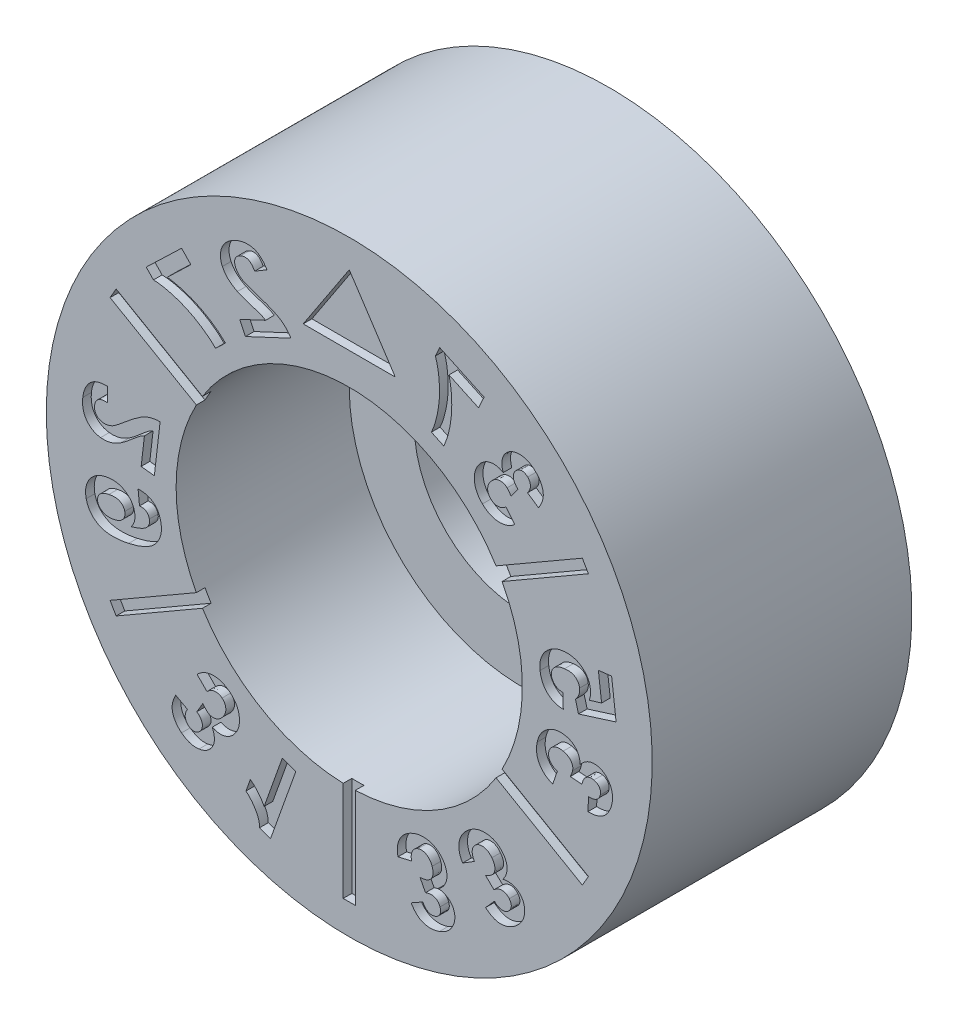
SolidWorks part; units mm, degrees
ref_plane "Front Plane" through (0, 0, 0) normal (0, 0, 1) x (1, 0, 0)
ref_plane "Top Plane" through (0, 0, 0) normal (0, 1, 0) x (1, 0, 0)
ref_plane "Right Plane" through (0, 0, 0) normal (1, 0, 0) x (0, 0, -1)
imported_body "Imported1"
other "Move Face1" parameters "D1"=0.22
other "DeleteFace2"
sketch "Sketch1" plane through (0, 0, 0) normal (0, 0, 1) x (1, 0, 0)
  line L0 (0, 0) -> (0, -3.9447) construction
  line L2 (-0.07, -1.65) -> (0.07, -1.65)
  line L3 (-0.07, -1.65) -> (-0.07, -3.15)
  line L4 (-0.07, -3.15) -> (0.07, -3.15)
  line L5 (0.07, -1.65) -> (0.07, -3.15)
  line L9 (0, 0) -> (-1.9723, -3.4162) construction
  line L10 (-1.4639, -0.7644) -> (-1.3939, -0.8856)
  line L11 (-1.3939, -0.8856) -> (-2.693, -1.6356)
  line L12 (-1.4639, -0.7644) -> (-2.763, -1.5144)
  line L13 (-2.763, -1.5144) -> (-2.693, -1.6356)
  line L14 (0, 0) -> (-3.4162, -1.9723) construction
  line L19 (0, 0) -> (-3.9447, 0) construction
  line L20 (-1.3939, 0.8856) -> (-1.4639, 0.7644)
  line L21 (-1.4639, 0.7644) -> (-2.763, 1.5144)
  line L22 (-1.3939, 0.8856) -> (-2.693, 1.6356)
  line L23 (-2.693, 1.6356) -> (-2.763, 1.5144)
  line L24 (0, 0) -> (-3.4162, 1.9723) construction
  line L29 (0, 0) -> (-1.9723, 3.4162) construction
  line L34 (0, 0) -> (0, 3.9447) construction
  line L39 (0, 0) -> (1.9723, 3.4162) construction
  line L40 (1.4639, 0.7644) -> (1.3939, 0.8856)
  line L41 (1.3939, 0.8856) -> (2.693, 1.6356)
  line L42 (1.4639, 0.7644) -> (2.763, 1.5144)
  line L43 (2.763, 1.5144) -> (2.693, 1.6356)
  line L44 (0, 0) -> (3.4162, 1.9723) construction
  line L49 (0, 0) -> (3.9447, 0) construction
  line L50 (1.3939, -0.8856) -> (1.4639, -0.7644)
  line L51 (1.4639, -0.7644) -> (2.763, -1.5144)
  line L52 (1.3939, -0.8856) -> (2.693, -1.6356)
  line L53 (2.693, -1.6356) -> (2.763, -1.5144)
  line L54 (0, 0) -> (3.4162, -1.9723) construction
  line L59 (0, 0) -> (1.9723, -3.4162) construction
  line L60 (0.07, 3.15) -> (-0.07, 3.15)
  line L61 (0.07, 1.65) -> (0.07, 3.15)
  line L62 (-0.07, 1.65) -> (-0.07, 3.15)
  line L63 (0.07, 1.65) -> (-0.07, 1.65)
  line L64 (-0.7644, 1.4639) -> (-1.5144, 2.763)
  line L65 (-1.5144, 2.763) -> (-1.6356, 2.693)
  line L66 (-0.8856, 1.3939) -> (-1.6356, 2.693)
  line L67 (-0.7644, 1.4639) -> (-0.8856, 1.3939)
  line L68 (0.8856, 1.3939) -> (1.6356, 2.693)
  line L69 (0.8856, 1.3939) -> (0.7644, 1.4639)
  line L70 (0.7644, 1.4639) -> (1.5144, 2.763)
  line L71 (-1.65, 0.07) -> (-3.15, 0.07)
  line L72 (-1.65, -0.07) -> (-3.15, -0.07)
  line L73 (-3.15, 0.07) -> (-3.15, -0.07)
  line L74 (-1.65, 0.07) -> (-1.65, -0.07)
  line L75 (1.65, 0.07) -> (3.15, 0.07)
  line L76 (3.15, -0.07) -> (3.15, 0.07)
  line L77 (1.65, -0.07) -> (3.15, -0.07)
  line L78 (1.65, -0.07) -> (1.65, 0.07)
  line L79 (-0.7644, -1.4639) -> (-1.5144, -2.763)
  line L80 (-0.8856, -1.3939) -> (-1.6356, -2.693)
  line L81 (-1.6356, -2.693) -> (-1.5144, -2.763)
  line L82 (-0.8856, -1.3939) -> (-0.7644, -1.4639)
  line L83 (0.8856, -1.3939) -> (1.6356, -2.693)
  line L84 (0.7644, -1.4639) -> (1.5144, -2.763)
  line L85 (0.7644, -1.4639) -> (0.8856, -1.3939)
  line L86 (1.5144, -2.763) -> (1.6356, -2.693)
  line L87 (1.6356, 2.693) -> (1.5144, 2.763)
  arc A0 (-0.6463, 2.1656) -> (0, 2.26) centre (0, 0) ccw construction
  text T0 "27  29  31  33  35  37" font "Arial" height 0.87
  point P66 (0, 0)
  dimension "D1" = 4.52
  dimension "D6" = 12
extrude "Cut-Extrude1" cut sketch "Sketch1" against normal blind 0.1
other "Move Face3" parameters "D1"=1
other "Move Face2" parameters "D1"=2
sketch "Sketch2" plane through (0, 0, 0) normal (0, 1, 0) x (1, 0, 0)
  line L0 (3.5, 3) -> (-3.5, 3) construction
  line L1 (-2.2, 3) -> (-2.8, 3)
  arc A0 (-2.8, 3) -> (-2.2, 3) centre (-2.5, 3) cw
  dimension "D2" = 0.3
  dimension "D1" = 2.5
revolve "Revolve1" add sketch "Sketch2" angle 360 about L1
